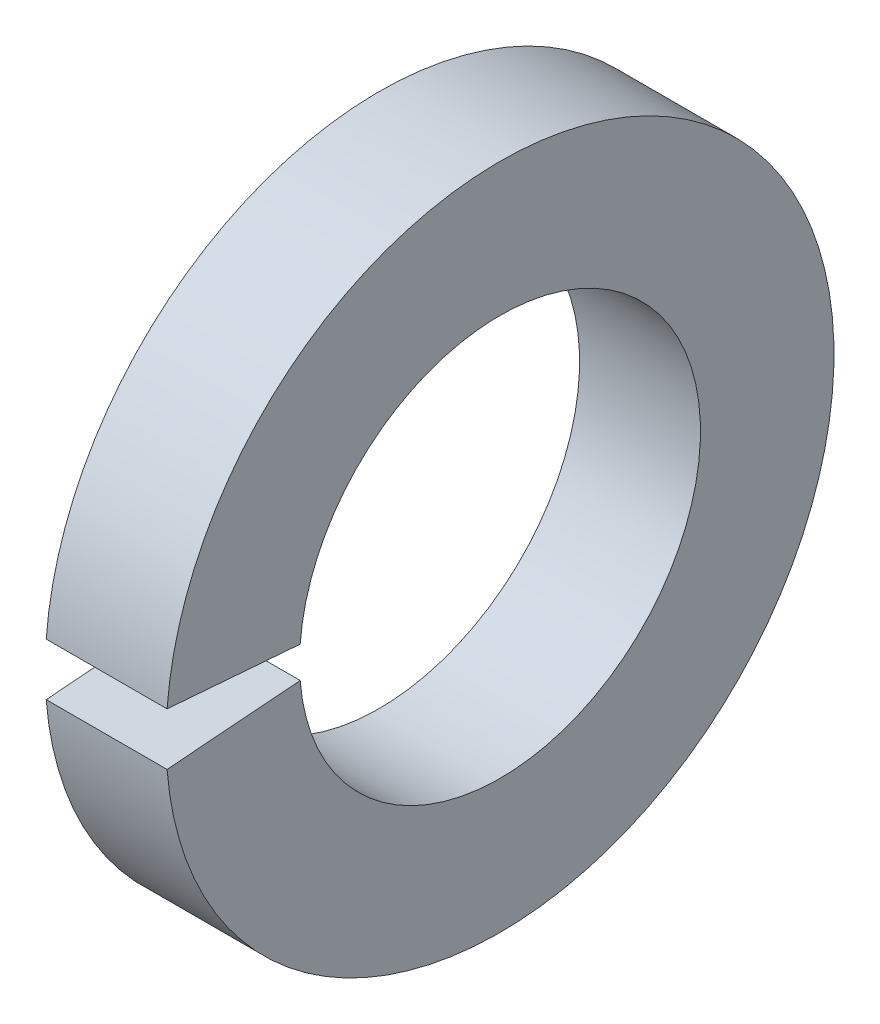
SolidWorks part; units mm, degrees
ref_plane "Plane1" through (0, 0, 0) normal (0, 0, 1) x (1, 0, 0)
ref_plane "Plane2" through (0, 0, 0) normal (0, 1, 0) x (1, 0, 0)
ref_plane "Plane3" through (0, 0, 0) normal (1, 0, 0) x (0, 0, -1)
sketch "Sketch1" plane through (0, 0, 0) normal (0, 0, 1) x (1, 0, 0)
  line L0 (-34.925, 0) -> (9.525, 0) construction
  line L1 (0, 12.8905) -> (0, 21.4757)
  line L2 (0, 21.4757) -> (-7.7724, 21.4757)
  line L3 (-7.7724, 21.4757) -> (-7.7724, 12.8905)
  line L4 (-7.7724, 12.8905) -> (0, 12.8905)
  dimension "Thickness" = 7.7724
  dimension "Inside_dia" = 25.781
  dimension "Outside_dia" = 42.9514
revolve "Base-Revolve" add sketch "Sketch1" angle 360 about L0
sketch "Sketch2" plane through (0, 0, 0) normal (-1, 0, 0) x (0, -1, 0)
  line L0 (0, 0) -> (1.7187, 21.8377)
  line L1 (0, -3.175) -> (0, 12.7) construction
  line L2 (0, 0) -> (-1.7187, 21.8377)
  arc A0 (1.7187, 21.8377) -> (-1.7187, 21.8377) centre (0, 0) ccw
  dimension "D1" = 21.9052
  dimension "Gap_ang" = 9
extrude "Gap" cut sketch "Sketch2" along normal through all
equation "\"D1@Sketch2\" = \"Outside_dia@Sketch1\" * 0.51"
